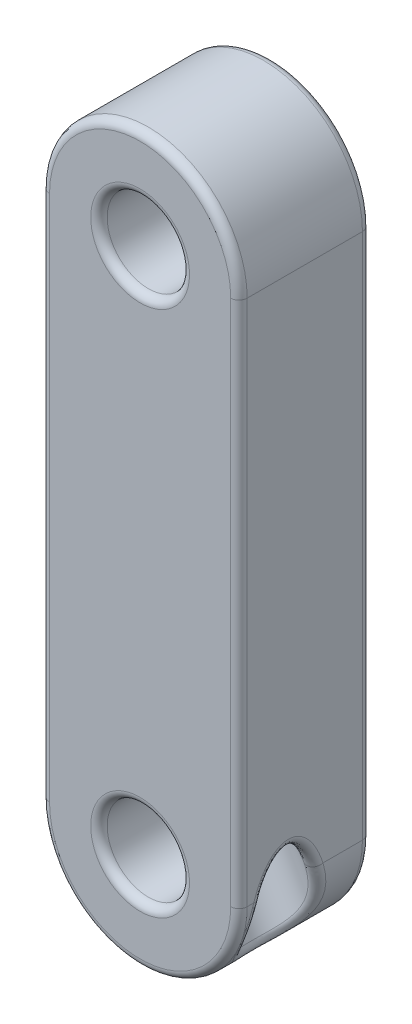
SolidWorks part; units mm, degrees
ref_plane "Спереди" through (0, 0, 0) normal (0, 0, 1) x (1, 0, 0)
ref_plane "Сверху" through (0, 0, 0) normal (0, 1, 0) x (1, 0, 0)
ref_plane "Справа" through (0, 0, 0) normal (1, 0, 0) x (0, 0, -1)
sketch "Эскиз1" plane through (0, 0, 0) normal (0, 0, 1) x (1, 0, 0)
  line L0 (0, 0) -> (0, 16) construction
  line L1 (0, 0) -> (0, -16) construction
  line L2 (-6, 16) -> (-6, -16)
  line L3 (6, 16) -> (6, -16)
  circle A0 centre (0, 16) radius 2.5
  circle A1 centre (0, -16) radius 2.5
  arc A2 (6, 16) -> (-6, 16) centre (0, 16) ccw
  arc A3 (-6, -16) -> (6, -16) centre (0, -16) ccw
  dimension "D2" = 5
  dimension "D3" = 12
  dimension "D1" = 32
extrude "Бобышка-Вытянуть1" add sketch "Эскиз1" along normal mid plane 8
fillet "Скругление1" radius 0.5 12 edges at (2.5, -16, -4) (-6, 0, -4) (0, -22, -4) (6, 0, -4) (0, 22, -4) (2.5, 16, -4) (2.5, -16, 4) (6, 0, 4) (0, -22, 4) (-6, 0, 4) (0, 22, 4) (2.5, 16, 4)
extrude "Вырез-Вытянуть1" cut sketch "Эскиз2" along normal through all
sketch "Эскиз2" plane through (-22.5155, 29.7619, 1) normal (0.5005, -0.8657, 0) x (-0.8657, -0.5005, 0)
  line L4 (0, 0) -> (-149.3284, 0) construction
  line L6 (0, 3) -> (-149.3317, 3) construction
  circle A0 centre (0, 0) radius 2
  circle A1 centre (0, 3) radius 2 construction
fillet "Скругление2" radius 0.5 4 edges at (-6, 5.1899, 1) (0.2444, -13.512, 1.4258) (4.1632, -20.3206, 0.6503) (6, -15.5674, 1)
